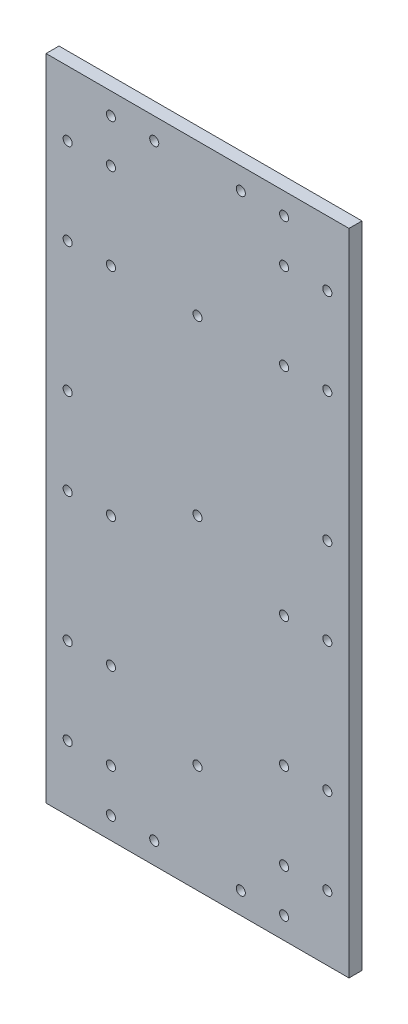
SolidWorks part; units mm, degrees
ref_plane "Alzado" through (0, 0, 0) normal (0, 0, 1) x (1, 0, 0)
ref_plane "Planta" through (0, 0, 0) normal (0, 1, 0) x (1, 0, 0)
ref_plane "Vista lateral" through (0, 0, 0) normal (1, 0, 0) x (0, 0, -1)
ref_plane "Plano1" through (0, 0, 0) normal (0, 0, -1) x (-1, 0, 0)
sketch "Croquis1" plane through (0, 0, 0) normal (0, 0, -1) x (-1, 0, 0)
  line L0 (0, 0) -> (0, 300)
  line L1 (0, 300) -> (-140, 300)
  line L2 (-140, 300) -> (-140, 0)
  line L3 (-140, 0) -> (0, 0)
  point P4 (0, 0)
  dimension "D1" = 140
  dimension "D2" = 300
extrude "Saliente-Extruir1" add sketch "Croquis1" against normal blind 6
hole_wizard "Taladro roscado M5x0.81" positions "Croquis3" profile "Croquis2" tap size "M5x0.8" standard "Ansi Metric"
sketch "Croquis3" plane through (0, 0, 6) normal (0, 0, 1) x (1, 0, 0)
  line L0 (0, 0) -> (0, 300) construction
  line L3 (0, 300) -> (140, 300) construction
  point P0 (90, 290)
  point P3 (130, 270)
  point P4 (110, 270)
  point P7 (30, 270)
  point P8 (10, 270)
  point P15 (130, 230)
  point P16 (110, 230)
  point P20 (10, 230)
  point P40 (30, 130)
  point P42 (110, 130)
  point P50 (10, 70)
  point P53 (130, 70)
  point P55 (70, 50)
  point P57 (10, 30)
  point P60 (130, 30)
  point P61 (110, 10)
  point P64 (50, 290)
  point P75 (30, 230)
  point P85 (130, 170)
  point P87 (130, 130)
  point P89 (10, 130)
  point P91 (10, 170)
  point P108 (30, 290)
  point P110 (110, 290)
  point P112 (90, 10)
  point P114 (50, 10)
  point P116 (30, 10)
  point P120 (110, 30)
  point P122 (110, 70)
  point P124 (30, 70)
  point P126 (30, 30)
  point P133 (70, 230)
  point P137 (70, 150)
  point P160 (10, 270)
  point P162 (10, 230)
  dimension "D1" = 30
  dimension "D2" = 20
  dimension "D3" = 40
  dimension "D4" = 20
  dimension "D5" = 20
  dimension "D6" = 10
  dimension "D7" = 20
  dimension "D8" = 40
  dimension "D9" = 60
  dimension "D10" = 20
  dimension "D11" = 20
  dimension "D12" = 60
  dimension "D13" = 20
  dimension "D14" = 20
  dimension "D15" = 20
sketch "Croquis2" plane through (90, 290, 6) normal (1, 0, 0) x (0, -1, 0)
  line L0 (0, 0) -> (0, 6)
  line L1 (0, 6) -> (2.1, 6)
  line L2 (2.1, 6) -> (2.1, 0)
  line L5 (2.1, 0) -> (0, 0)
  line L11 (0, -6.35) -> (0, 107.95) construction
  dimension "Diámetro de perforador para roscar hasta el siguiente" = 4.2
  dimension "Profundidad de perforador para roscar hasta el siguiente" = 6
